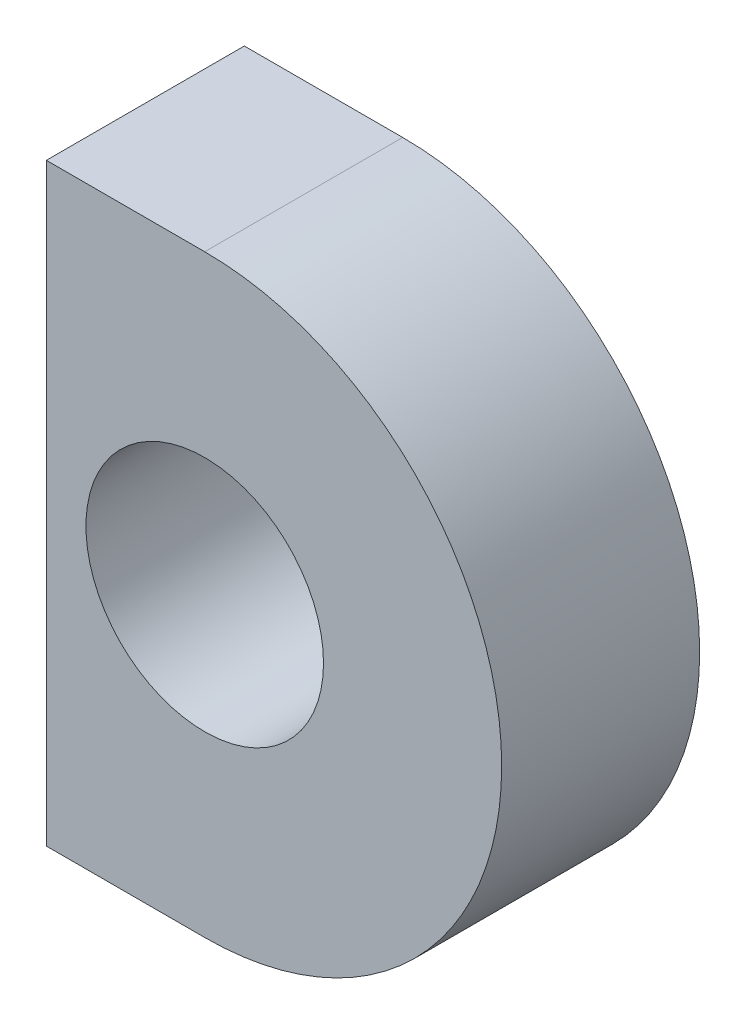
SolidWorks part; units mm, degrees
ref_plane "Face" through (0, 0, 0) normal (0, 0, 1) x (1, 0, 0)
ref_plane "Dessus" through (0, 0, 0) normal (0, 1, 0) x (1, 0, 0)
ref_plane "Droite" through (0, 0, 0) normal (1, 0, 0) x (0, 0, -1)
sketch "Esquisse1" plane through (0, 0, 0) normal (0, 0, 1) x (1, 0, 0)
  line L1 (0, 0) -> (10, 0)
  line L2 (0, 0) -> (0, -30)
  line L3 (0, -30) -> (10, -30)
  arc A0 (10, -30) -> (10, 0) centre (10, -15) ccw
  dimension "D1" = 30
extrude "Extrusion1" add sketch "Esquisse1" along normal blind 10
sketch "Esquisse2" plane through (0, 0, 10) normal (0, 0, 1) x (1, 0, 0)
  circle A0 centre (10, -15) radius 6
extrude "Enlèv. mat.-Extru.1" cut sketch "Esquisse2" against normal blind 10
chamfer "Chanfrein1" distance 2 angle 45 2 edges at (0, -15, 0) (0, -15, 10)
chamfer "Chanfrein2" distance 2 angle 45 1 edges at (0, 0, 5)
